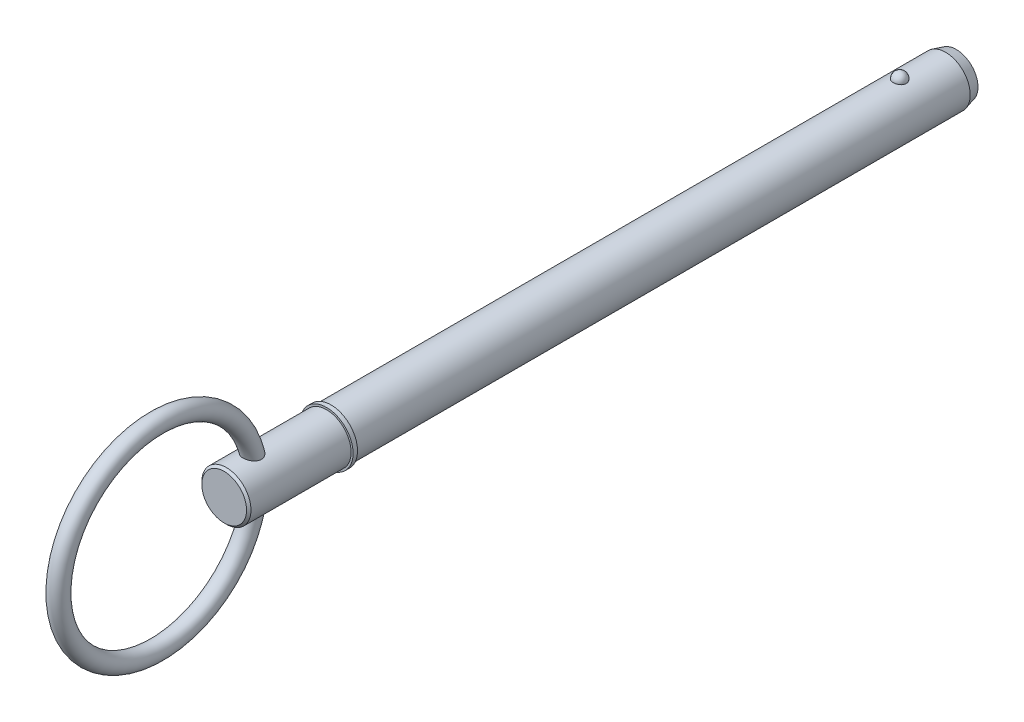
SolidWorks part; units mm, degrees
ref_plane "Front Plane" through (0, 0, 0) normal (0, 0, 1) x (1, 0, 0)
ref_plane "Top Plane" through (0, 0, 0) normal (0, 1, 0) x (1, 0, 0)
ref_plane "Right Plane" through (0, 0, 0) normal (1, 0, 0) x (0, 0, -1)
sketch "Sketch2" plane through (0, 0, 0) normal (0, 0, 1) x (1, 0, 0)
  circle A0 centre (0, 0) radius 5.555
  point P3 (0, 5.555)
  dimension "D1" = 11.11
extrude "Boss-Extrude1" add sketch "Sketch2" along normal blind 127
sketch "Sketch3" plane through (0, 0, 0) normal (0, 0, -1) x (-1, 0, 0)
  circle A0 centre (0, 0) radius 5.555
  dimension "D1" = 11.11
extrude "Boss-Extrude2" add sketch "Sketch3" along normal blind 14.27
chamfer "Chamfer1" distance 2.4 angle 15 1 edges at (-5.555, 0, -14.27)
sketch "Sketch18" plane through (0, 0, 0) normal (1, 0, 0) x (0, 0, -1)
  line L0 (11.87, 5.555) -> (-127, 5.555) construction
  line L1 (1.49, 7.045) -> (1.49, 4.065)
  line L2 (-127, -5.555) -> (11.87, -5.555) construction
  arc A0 (1.49, 7.045) -> (1.49, 4.065) centre (1.49, 5.555) ccw
  point P4 (0, 5.555)
  dimension "D1" = 12.6
revolve "Revolve1" add sketch "Sketch18" angle 360 about L1
sketch "Sketch19" plane through (0, 0, 0) normal (1, 0, 0) x (0, 0, -1)
  line L0 (-33.7288, 0) -> (-46.4542, 0) construction
sketch "Sketch20" plane through (0, 0, 0) normal (1, 0, 0) x (0, 0, -1)
  line L0 (-127, 0) -> (-127, 6)
  line L1 (-127, 5.555) -> (-127, -5.555) construction
  line L2 (-127, 6) -> (-128, 6)
  line L3 (-128, 6) -> (-128, 0)
  line L4 (-33.7288, 0) -> (-46.4542, 0) construction
  line L5 (-128, 0) -> (-127, 0)
  dimension "D1" = 6
  dimension "D2" = 1
revolve "Revolve2" add sketch "Sketch20" angle 360 about L0
sketch "Sketch21" plane through (0, 0, 127) normal (0, 0, -1) x (-1, 0, 0)
  circle A0 centre (0, 0) radius 5.555
  dimension "D1" = 11.11
extrude "Boss-Extrude3" add sketch "Sketch21" against normal blind 24.13
chamfer "Chamfer2" distance 0.5 angle 45 1 edges at (-5.555, 0, 151.13)
sketch "Sketch23" plane through (0, 0, 0) normal (1, 0, 0) x (0, 0, -1)
  line L0 (-151.13, 5.055) -> (-151.13, -5.055) construction
  circle A0 centre (-166.355, 0) radius 22.225
  point P2 (-144.13, 0)
  dimension "D1" = 44.45
  dimension "D2" = 7
sketch "Sketch24" plane through (0, 0, 0) normal (0, 1, 0) x (1, 0, 0)
  circle A0 centre (0, -144.13) radius 2
  dimension "D1" = 4
sweep "Sweep1" add profiles "Sketch24" path "Sketch23"
